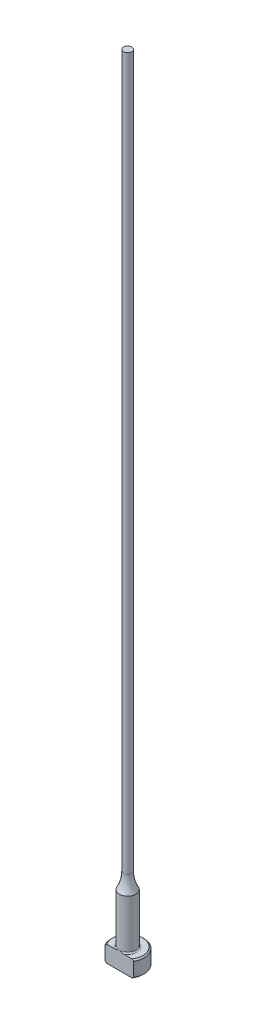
SolidWorks part; units mm, degrees
ref_plane "Front Plane" through (0, 0, 0) normal (0, 0, 1) x (1, 0, 0)
ref_plane "Top Plane" through (0, 0, 0) normal (0, 1, 0) x (1, 0, 0)
ref_plane "Right Plane" through (0, 0, 0) normal (1, 0, 0) x (0, 0, -1)
sketch "Sketch1" plane through (0, 0, 0) normal (0, 0, 1) x (1, 0, 0)
  line L0 (0, 259.9588) -> (0, -15.1925) construction
  line L1 (0, 0) -> (-3.175, 0)
  line L2 (-3.175, 0) -> (-3.175, 3.175)
  line L3 (-3.175, 3.175) -> (-1.5875, 3.175)
  line L4 (-0.7937, 15.7742) -> (-0.7937, 152.4)
  line L5 (-0.7937, 152.4) -> (0, 152.4)
  line L6 (0, 152.4) -> (0, 0)
  line L7 (-1.5875, 3.175) -> (-1.5875, 12.7)
  arc A0 (-1.5875, 12.7) -> (-0.7937, 15.7742) centre (-7.1437, 15.7742) ccw
  point P13 (-1.5875, 0)
  dimension "D1" = 6.35
  dimension "L" = 152.4
  dimension "D2" = 3.175
  dimension "H" = 6.35
  dimension "T" = 3.175
  dimension "D" = 1.5875
  dimension "S" = 12.7
revolve "Revolve1" add sketch "Sketch1" angle 360 about L0
chamfer "Chamfer1" distance 0.254 angle 45 2 edges at (0, 3.175, 3.175) (0, 0, 3.175)
fillet "Fillet1" radius 0.254 1 edges at (0, 3.175, 1.5875)
sketch "Sketch2" plane through (0, 0, 0) normal (0, -1, 0) x (1, 0, 0)
  line L0 (-2.7496, 1.5875) -> (2.7496, 1.5875)
  arc A0 (2.7496, 1.5875) -> (-2.7496, 1.5875) centre (0, 0) ccw
  circle A1 centre (0, 0) radius 3.175 construction
  circle A2 centre (0, 0) radius 1.5875 construction
extrude "Cut-Extrude1" cut sketch "Sketch2" against normal through all
